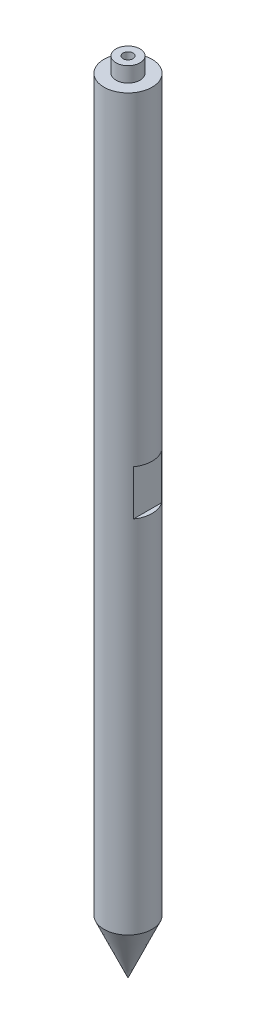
SolidWorks part; units mm, degrees
ref_plane "前视基准面" through (0, 0, 0) normal (0, 0, 1) x (1, 0, 0)
ref_plane "上视基准面" through (0, 0, 0) normal (0, 1, 0) x (1, 0, 0)
ref_plane "右视基准面" through (0, 0, 0) normal (1, 0, 0) x (0, 0, -1)
sketch "草图1" plane through (0, 0, 0) normal (0, 0, 1) x (1, 0, 0)
  line L9 (0, 0) -> (-8, 0)
  line L10 (-8, 0) -> (-8, -242)
  line L14 (0, -260) -> (0, 0)
  line L16 (-8, -242) -> (0, -260)
revolve "旋转1" add sketch "草图1" angle 360 about L14
sketch "草图4" plane through (0, 0, 0) normal (0, 1, 0) x (1, 0, 0)
  line L0 (0, 8) -> (0, -8) construction
  circle A1 centre (0, 0) radius 8 construction
  point P5 (0, 0)
ref_plane "基准面1" through (0, 0, 10.5) normal (0, 0, 1) x (1, 0, 0)
sketch "草图10" plane through (0, 0, 0) normal (0, 1, 0) x (1, 0, 0)
  circle A0 centre (0, 0) radius 4
  dimension "D1" = 8
extrude "凸台-拉伸1" add sketch "草图10" along normal blind 5
sketch "草图19" plane through (0, 0, 0) normal (0, 0, 1) x (1, 0, 0)
  line L0 (0, 5) -> (0, -260) construction
  line L1 (4, 5) -> (-4, 5) construction
  line L3 (-6.5, -122.5) -> (6.5, -122.5) construction
  line L4 (-6.5, -122.5) -> (-6.5, -107.5) construction
  line L5 (-6.5, -107.5) -> (6.5, -107.5) construction
  line L6 (6.5, -122.5) -> (6.5, -107.5) construction
  line L7 (-6.5, -122.5) -> (6.5, -107.5) construction
  line L8 (-6.5, -107.5) -> (6.5, -122.5) construction
  line L9 (6.5, -107.5) -> (46.5, -107.5)
  line L10 (6.5, -107.5) -> (6.5, -122.5)
  line L11 (6.5, -122.5) -> (46.5, -122.5)
  line L12 (46.5, -107.5) -> (46.5, -122.5)
  line L13 (-6.5, -107.5) -> (-46.5, -107.5)
  line L14 (-6.5, -107.5) -> (-6.5, -122.5)
  line L15 (-6.5, -122.5) -> (-46.5, -122.5)
  line L16 (-46.5, -107.5) -> (-46.5, -122.5)
  point P5 (0, -115)
extrude "切除-拉伸1" cut sketch "草图19" against normal through all and the other way through all
hole_wizard "M4 螺纹孔1" positions "草图21" profile "草图22" tap size "M4" standard "ISO"
sketch "草图21" plane through (0, 5, 0) normal (0, 1, 0) x (1, 0, 0)
  point P0 (0, 0)
sketch "草图22" plane through (0, 5, 0) normal (1, 0, 0) x (0, 0, 1)
  line L0 (0, 0) -> (0, 11.0914)
  line L1 (0, 11.0914) -> (1.65, 10.1)
  line L2 (1.65, 10.1) -> (1.65, 0)
  line L5 (1.65, 0) -> (0, 0)
  line L10 (0, 11.0914) -> (-1.65, 10.1) construction
  line L11 (0, -6.35) -> (0, 107.95) construction
  dimension "螺纹孔钻头直径" = 3.3
  dimension "螺纹孔钻头深度" = 10.1
  dimension "导头角度" = 118
equation "\"总长度\"= 260"
equation "\"顶螺纹长度\"=5"
equation "\"台阶长度\"= 10"
equation "\"顶尖长度\"= 15"
equation "\"中段长度\"= \"总长度\" - \"顶螺纹长度\" - \"顶螺纹长度\" - \"台阶长度\""
equation "\"D4@草图1\"=\"总长度\""
equation "\"半径\"= 8"
equation "\"D1@凸台-拉伸1\"=\"顶螺纹长度\""
equation "\"D1@草图19\"=\"中段长度\"/2"
equation "\"D2@草图19\"=\"半径\"*2-3"
equation "\"D1@草图1\"=\"半径\""
